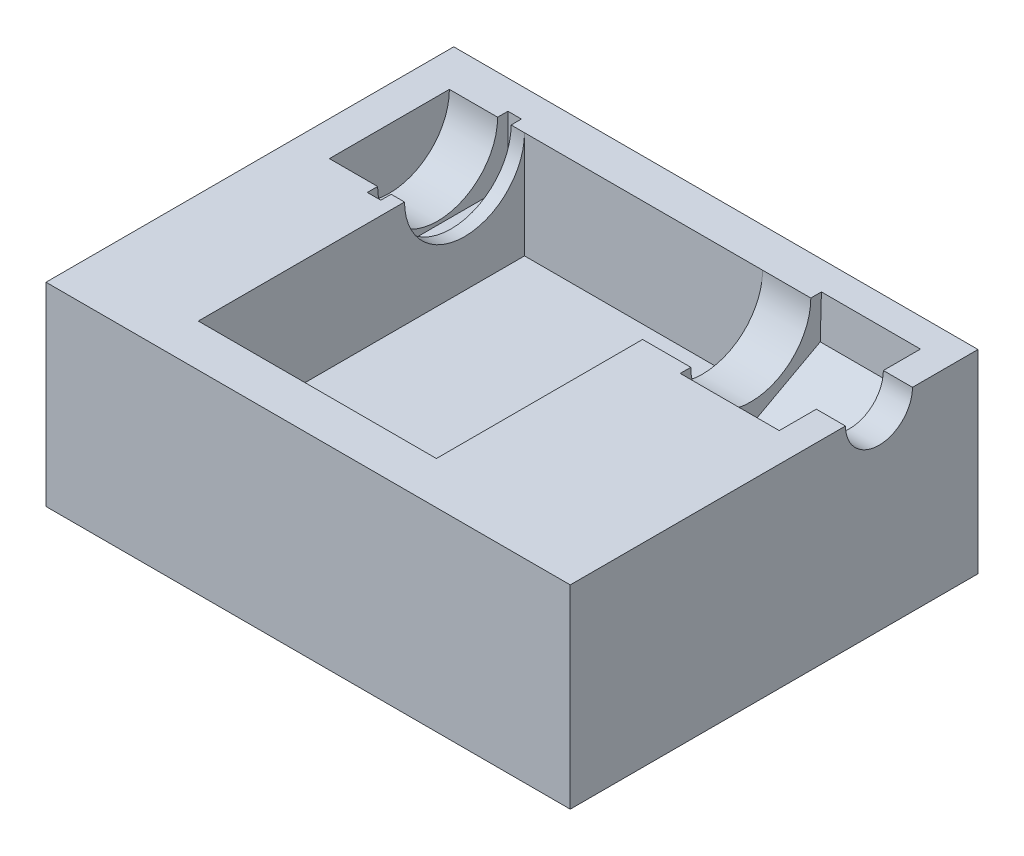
SolidWorks part; units mm, degrees
ref_plane "Alzado" through (0, 0, 0) normal (0, 0, 1) x (1, 0, 0)
ref_plane "Planta" through (0, 0, 0) normal (0, 1, 0) x (1, 0, 0)
ref_plane "Vista lateral" through (0, 0, 0) normal (1, 0, 0) x (0, 0, -1)
sketch "Croquis1" plane through (0, 0, 0) normal (0, 1, 0) x (1, 0, 0)
  line L1 (-45, -35) -> (45, -35)
  line L2 (-45, -35) -> (-45, 35)
  line L3 (-45, 35) -> (45, 35)
  line L4 (45, -35) -> (45, 35)
  line L5 (-45, -35) -> (45, 35) construction
  line L6 (-45, 35) -> (45, -35) construction
  point P0 (0, 0)
extrude "Saliente-Extruir1" add sketch "Croquis1" along normal blind 33.35
sketch "Croquis2" plane through (45, 0, 0) normal (1, 0, 0) x (0, 0, -1)
  line L0 (35, 33.35) -> (18, 33.35) construction
  line L1 (-35, 33.35) -> (35, 33.35) construction
  circle A0 centre (18, 33.35) radius 5.75
extrude "Cortar-Extruir1" cut sketch "Croquis2" against normal blind 5 contours A0
sketch "Croquis5" plane through (40, 0, 0) normal (1, 0, 0) x (0, 0, -1)
  line L0 (23.75, 33.35) -> (12.25, 33.35) construction
  line L1 (30.3041, 40.0068) -> (18.3871, 47.3341)
  line L2 (18.3871, 47.3341) -> (6.083, 40.6772)
  line L3 (6.083, 40.6772) -> (5.6959, 26.6932)
  line L4 (5.6959, 26.6932) -> (17.6129, 19.3659)
  line L5 (17.6129, 19.3659) -> (29.917, 26.0228)
  line L6 (29.917, 26.0228) -> (30.3041, 40.0068)
  circle A0 centre (18, 33.35) radius 12.1152 construction
extrude "Cortar-Extruir2" cut sketch "Croquis5" against normal blind 17
sketch "Croquis6" plane through (23, 0, 0) normal (1, 0, 0) x (0, 0, -1)
  line L0 (30.1198, 33.35) -> (5.8802, 33.35) construction
  circle A0 centre (18, 33.35) radius 10.3
extrude "Cortar-Extruir3" cut sketch "Croquis6" against normal blind 8.28
sketch "Croquis8" plane through (0, 33.35, 0) normal (0, 1, 0) x (1, 0, 0)
  line L1 (14.72, 28.3) -> (-26.15, 28.3)
  line L2 (14.72, 28.3) -> (14.72, -27.7)
  line L3 (14.72, -27.7) -> (-26.15, -27.7)
  line L4 (-26.15, 28.3) -> (-26.15, -27.7)
extrude "Cortar-Extruir4" cut sketch "Croquis8" against normal blind 18.315 contours L2 L3 L4 L1
sketch "Croquis13" plane through (-26.15, 0, 0) normal (1, 0, 0) x (0, 0, -1)
  line L0 (28.3, 33.35) -> (18, 33.35) construction
  line L1 (28.3, 33.35) -> (-27.7, 33.35) construction
  circle A0 centre (18, 33.35) radius 10.3
extrude "Cortar-Extruir6" cut sketch "Croquis13" against normal blind 2.3
sketch "Croquis14" plane through (-28.45, 0, 0) normal (1, 0, 0) x (0, 0, -1)
  line L3 (30.07, 22.45) -> (5.93, 22.45)
  line L4 (30.07, 22.45) -> (30.07, 44.25)
  line L5 (30.07, 44.25) -> (5.93, 44.25)
  line L6 (5.93, 22.45) -> (5.93, 44.25)
  line L7 (30.07, 22.45) -> (5.93, 44.25) construction
  line L8 (30.07, 44.25) -> (5.93, 22.45) construction
extrude "Cortar-Extruir7" cut sketch "Croquis14" against normal blind 2.32
sketch "Croquis15" plane through (-30.77, 0, 0) normal (1, 0, 0) x (0, 0, -1)
  line L0 (30.07, 33.35) -> (5.93, 33.35) construction
  circle A0 centre (18, 33.35) radius 10.3
extrude "Cortar-Extruir8" cut sketch "Croquis15" against normal blind 8.28 contours A0
